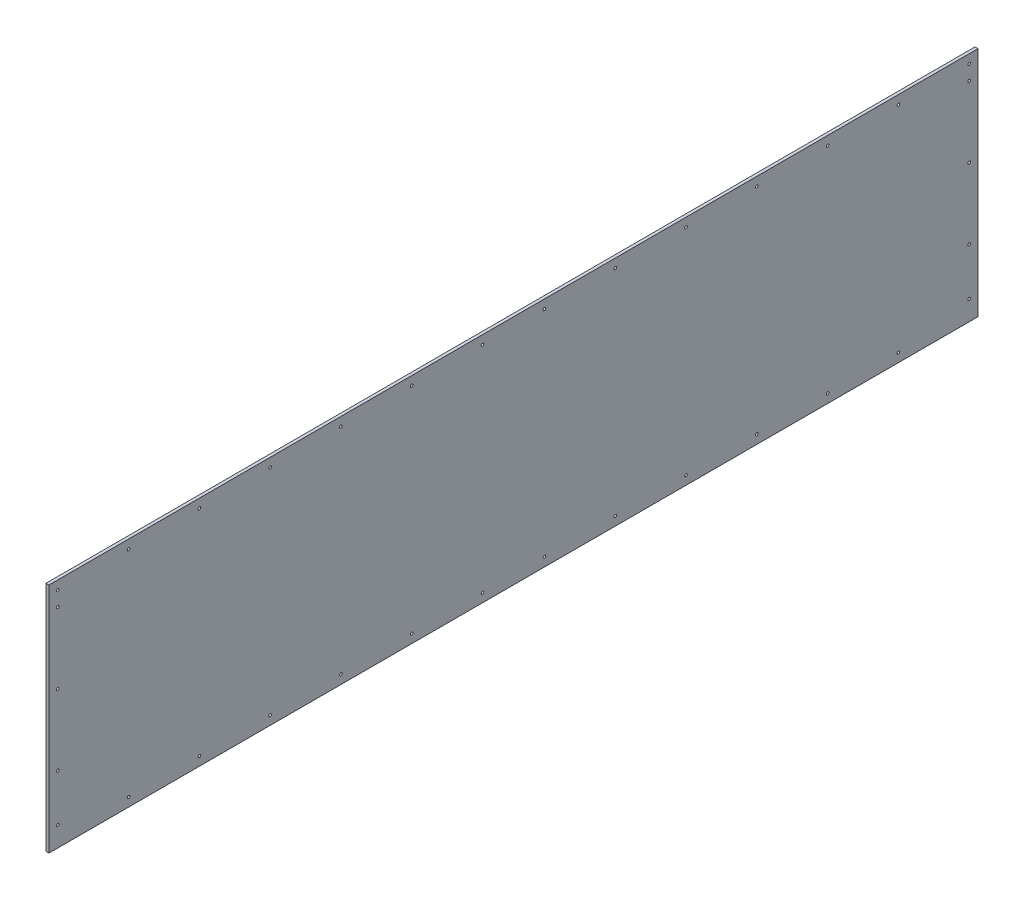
SolidWorks part; units mm, degrees
ref_plane "Front Plane" through (0, 0, 0) normal (0, 0, 1) x (1, 0, 0)
ref_plane "Top Plane" through (0, 0, 0) normal (0, 1, 0) x (1, 0, 0)
ref_plane "Right Plane" through (0, 0, 0) normal (1, 0, 0) x (0, 0, -1)
sketch "Sketch1" plane through (0, 0, 0) normal (1, 0, 0) x (0, 0, -1)
  line L1 (0, 0) -> (2000.25, 0)
  line L2 (0, 0) -> (0, 550.799)
  line L3 (0, 550.799) -> (2000.25, 550.799)
  line L4 (2000.25, 0) -> (2000.25, 550.799)
  dimension "D1" = 550.799
  dimension "D2" = 2000.25
extrude "Boss-Extrude1" add sketch "Sketch1" along normal blind 6.35
sketch "Sketch2" plane through (6.35, 0, 0) normal (1, 0, 0) x (0, 0, -1)
  line L0 (-104.2438, 531.749) -> (2101.8043, 531.749) construction
  line L1 (1981.2, -49.378) -> (1981.2, 744.0079) construction
  line L2 (19.05, 681.6459) -> (19.05, -49.378) construction
  line L3 (2000.25, 550.799) -> (0, 550.799) construction
  line L4 (0, 550.799) -> (0, 0) construction
  line L5 (2000.25, 0) -> (2000.25, 550.799) construction
  line L6 (1000.125, -49.378) -> (1000.125, 608.3944) construction
  line L7 (2000.25, 550.799) -> (0, 550.799) construction
  line L8 (2000.25, 275.3995) -> (-104.2438, 275.3995) construction
  line L9 (2035.2893, 300.7995) -> (-213.3443, 300.7995) construction
  circle A0 centre (19.05, 531.749) radius 2.8067
  circle A1 centre (19.05, 347.599) radius 2.8067
  circle A2 centre (171.45, 69.85) radius 2.8067
  circle A3 centre (19.05, 195.199) radius 2.8067
  circle A4 centre (19.05, 93.599) radius 2.8067
  circle A5 centre (323.85, 69.85) radius 2.8067
  circle A6 centre (476.25, 69.85) radius 2.8067
  circle A7 centre (628.65, 69.85) radius 2.8067
  circle A8 centre (781.05, 69.85) radius 2.8067
  circle A9 centre (933.45, 69.85) radius 2.8067
  circle A10 centre (1066.8, 69.85) radius 2.8067
  circle A11 centre (1219.2, 69.85) radius 2.8067
  circle A12 centre (1371.6, 69.85) radius 2.8067
  circle A13 centre (1524, 69.85) radius 2.8067
  circle A14 centre (1981.2, 195.199) radius 2.8067
  circle A15 centre (1676.4, 69.85) radius 2.8067
  circle A16 centre (1828.8, 69.85) radius 2.8067
  circle A19 centre (1981.2, 93.599) radius 2.8067
  circle A22 centre (19.05, 499.999) radius 2.8067
  circle A23 centre (171.45, 531.749) radius 2.8067
  circle A24 centre (323.85, 531.749) radius 2.8067
  circle A25 centre (476.25, 531.749) radius 2.8067
  circle A26 centre (628.65, 531.749) radius 2.8067
  circle A27 centre (781.05, 531.749) radius 2.8067
  circle A28 centre (933.45, 531.749) radius 2.8067
  circle A29 centre (1066.8, 531.749) radius 2.8067
  circle A30 centre (1219.2, 531.749) radius 2.8067
  circle A31 centre (1371.6, 531.749) radius 2.8067
  circle A32 centre (1524, 531.749) radius 2.8067
  circle A33 centre (1676.4, 531.749) radius 2.8067
  circle A34 centre (1828.8, 531.749) radius 2.8067
  circle A35 centre (1981.2, 531.749) radius 2.8067
  circle A36 centre (1981.2, 499.999) radius 2.8067
  circle A37 centre (1981.2, 347.599) radius 2.8067
  dimension "D4" = 5.6134
  dimension "D7" = 25.4
  dimension "D5" = 457.2
  dimension "D1" = 19.05
  dimension "D2" = 19.05
  dimension "D3" = 19.05
  dimension "D6" = 152.4
extrude "Cut-Extrude1" cut sketch "Sketch2" against normal through all
sketch "Sketch3" plane through (0, 0, 0) normal (-1, 0, 0) x (0, 0, 1)
  line L0 (-1000.125, 550.799) -> (-1000.125, 71.442) construction
  line L1 (-2000.25, 550.799) -> (0, 550.799) construction
  line L2 (-2000.25, 0) -> (-2000.25, 550.799) construction
  circle A0 centre (-1941.83, 461.899) radius 3.302
  circle A1 centre (-1941.83, 222.631) radius 3.302
  circle A2 centre (-1941.83, 184.531) radius 3.302
  circle A3 centre (-1000.125, 461.899) radius 3.302
  circle A4 centre (-1000.125, 222.631) radius 3.302
  circle A5 centre (-1000.125, 184.531) radius 3.302
  circle A6 centre (-58.42, 184.531) radius 3.302
  circle A7 centre (-58.42, 222.631) radius 3.302
  circle A8 centre (-58.42, 461.899) radius 3.302
  dimension "D1" = 6.604
  dimension "D6" = 6.604
  dimension "D2" = 88.9
  dimension "D3" = 58.42
  dimension "D4" = 239.268
  dimension "D5" = 38.1
extrude "vert mt holes" [suppressed] cut sketch "Sketch3" against normal through all
sketch "Sketch4" plane through (0, 0, 0) normal (-1, 0, 0) x (0, 0, 1)
  line L0 (0, 550.799) -> (0, 0) construction
  line L1 (-2000.25, 0) -> (0, 0)
  line L2 (-2000.25, 0) -> (-2000.25, 50.8)
  line L3 (-2000.25, 50.8) -> (0, 50.8)
  line L4 (0, 0) -> (0, 50.8)
  dimension "D1" = 50.8
extrude "Cut-Extrude2" cut sketch "Sketch4" against normal through all
